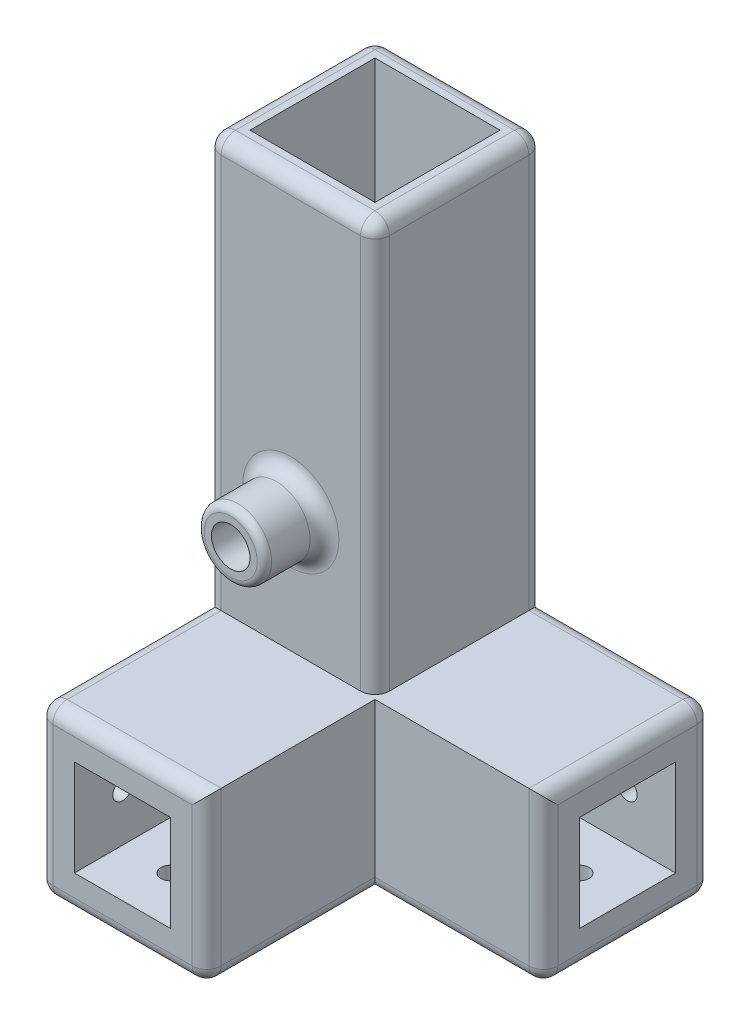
SolidWorks part; units mm, degrees
ref_plane "Alzado" through (0, 0, 0) normal (0, 0, 1) x (1, 0, 0)
ref_plane "Planta" through (0, 0, 0) normal (0, 1, 0) x (1, 0, 0)
ref_plane "Vista lateral" through (0, 0, 0) normal (1, 0, 0) x (0, 0, -1)
sketch "Sketch1" plane through (0, 0, 0) normal (0, 0, 1) x (1, 0, 0)
  line L0 (0, 70) -> (0, 0)
  line L1 (0, 0) -> (70, 0)
  line L2 (70, 0) -> (70, 35)
  line L3 (70, 35) -> (35, 35)
  line L4 (35, 35) -> (35, 70)
  line L5 (35, 70) -> (0, 70)
  dimension "D1" = 70
  dimension "D2" = 70
  dimension "D3" = 35
  dimension "D4" = 35
extrude "Boss-Extrude1" add sketch "Sketch1" along normal blind 35
sketch "Sketch2" plane through (0, 0, 35) normal (0, 0, 1) x (1, 0, 0)
  line L0 (35, 35) -> (0, 35)
  line L1 (0, 70) -> (0, 0) construction
  line L2 (0, 35) -> (0, 0)
  line L3 (0, 0) -> (35, 0)
  line L4 (0, 0) -> (70, 0) construction
  line L5 (35, 0) -> (35, 35)
extrude "Boss-Extrude2" add sketch "Sketch2" along normal blind 35
sketch "Sketch3" plane through (0, 0, 70) normal (0, 0, 1) x (1, 0, 0)
  line L0 (35, 0) -> (35, 35) construction
  line L1 (7.5, 27.5) -> (27.5, 27.5)
  line L2 (7.5, 27.5) -> (7.5, 7.5)
  line L3 (7.5, 7.5) -> (27.5, 7.5)
  line L4 (27.5, 27.5) -> (27.5, 7.5)
  line L5 (7.5, 27.5) -> (27.5, 7.5) construction
  line L6 (7.5, 7.5) -> (27.5, 27.5) construction
  line L7 (0, 0) -> (35, 0) construction
  point P0 (17.5, 17.5)
  dimension "D1" = 17.5
  dimension "D2" = 17.5
  dimension "D3" = 20
  dimension "D4" = 20
sketch "Sketch4" plane through (70, 0, 0) normal (1, 0, 0) x (0, 0, -1)
  line L0 (0, 0) -> (0, 35) construction
  line L1 (-27.5, 27.5) -> (-7.5, 27.5)
  line L2 (-27.5, 27.5) -> (-27.5, 7.5)
  line L3 (-27.5, 7.5) -> (-7.5, 7.5)
  line L4 (-7.5, 27.5) -> (-7.5, 7.5)
  line L5 (-27.5, 27.5) -> (-7.5, 7.5) construction
  line L6 (-27.5, 7.5) -> (-7.5, 27.5) construction
  line L7 (-35, 0) -> (0, 0) construction
  point P0 (-17.5, 17.5)
  dimension "D1" = 20
  dimension "D2" = 20
  dimension "D3" = 17.5
  dimension "D4" = 17.5
extrude "Cut-Extrude1" cut sketch "Sketch3" against normal blind 20 contours L3 L4 L1 L2
extrude "Cut-Extrude2" cut sketch "Sketch4" against normal blind 20 contours L3 L4 L1 L2
fillet "Fillet1" radius 3 14 edges at (35, 0, 0) (70, 17.5, 0) (52.5, 35, 0) (17.5, 35, 70) (0, 0, 35) (0, 17.5, 70) (0, 35, 52.5) (70, 35, 17.5) (70, 17.5, 35) (35, 17.5, 70) (70, 0, 17.5) (52.5, 0, 35) (35, 0, 52.5) (17.5, 0, 70)
sketch "Sketch7" plane through (0, 0, 0) normal (-1, 0, 0) x (0, 0, 1)
  line L1 (67, 0) -> (3, 0) construction
  line L2 (70, 32) -> (70, 3) construction
  circle A0 centre (60, 17.5) radius 2
  dimension "D2" = 4
  dimension "D3" = 17.5
  dimension "D4" = 10
extrude "Cut-Extrude4" cut sketch "Sketch7" against normal blind 10
sketch "Sketch8" plane through (0, 0, 0) normal (0, 0, -1) x (-1, 0, 0)
  line L0 (-70, 3) -> (-70, 32) construction
  line L1 (-67, 35) -> (-35, 35) construction
  circle A0 centre (-60, 17.5) radius 2
  dimension "D1" = 4
  dimension "D2" = 10
  dimension "D3" = 17.5
extrude "Cut-Extrude5" cut sketch "Sketch8" against normal blind 10
sketch "Sketch9" plane through (0, 70, 0) normal (0, 1, 0) x (1, 0, 0)
  line L1 (0, 0) -> (35, 0)
  line L2 (0, 0) -> (0, -35)
  line L3 (0, -35) -> (35, -35)
  line L4 (35, 0) -> (35, -35)
extrude "Boss-Extrude3" add sketch "Sketch9" along normal blind 50
sketch "Sketch10" plane through (0, 120, 0) normal (0, 1, 0) x (1, 0, 0)
  line L0 (35, 0) -> (0, 0) construction
  line L1 (4.5, -4.5) -> (30.5, -4.5)
  line L2 (4.5, -4.5) -> (4.5, -30.5)
  line L3 (4.5, -30.5) -> (30.5, -30.5)
  line L4 (30.5, -4.5) -> (30.5, -30.5)
  line L5 (4.5, -4.5) -> (30.5, -30.5) construction
  line L6 (4.5, -30.5) -> (30.5, -4.5) construction
  line L7 (0, 0) -> (0, -35) construction
  point P0 (17.5, -17.5)
  dimension "D1" = 26
  dimension "D2" = 26
  dimension "D3" = 17.5
  dimension "D4" = 17.5
extrude "Cut-Extrude6" cut sketch "Sketch10" against normal blind 50
fillet "Fillet2" radius 3 9 edges at (0.8787, 0.8787, 0.8787) (0, 61.5, 0) (0, 76, 35) (35, 76, 0) (17.5, 120, 0) (0, 120, 17.5) (17.5, 120, 35) (35, 77.5, 35) (35, 120, 17.5)
sketch "Sketch11" plane through (0, 0, 0) normal (-1, 0, 0) x (0, 0, 1)
  line L0 (35, 117) -> (35, 35) construction
  line L1 (3, 120) -> (32, 120) construction
  circle A0 centre (17.5, 100) radius 2
  dimension "D1" = 4
  dimension "D2" = 17.5
  dimension "D3" = 20
extrude "Cut-Extrude7" cut sketch "Sketch11" against normal blind 20
sketch "Sketch12" plane through (0, 0, 0) normal (0, 0, -1) x (-1, 0, 0)
  line L0 (-32, 120) -> (-3, 120) construction
  line L1 (0, 117) -> (0, 3) construction
  circle A0 centre (-17.5, 100) radius 2
  dimension "D1" = 4
  dimension "D2" = 20
  dimension "D3" = 17.5
extrude "Cut-Extrude8" cut sketch "Sketch12" against normal blind 20
sketch "Sketch13" plane through (0, 0, 0) normal (0, -1, 0) x (1, 0, 0)
  line L0 (67, 0) -> (3, 0) construction
  line L1 (70, 32) -> (70, 3) construction
  line L3 (35, 67) -> (35, 35) construction
  line L4 (3, 70) -> (32, 70) construction
  circle A0 centre (17.5, 60) radius 2
  circle A1 centre (60, 17.5) radius 2
  point P12 (17.1412, 61.9251)
  dimension "D1" = 4
  dimension "D2" = 4
  dimension "D3" = 17.5
  dimension "D4" = 10
  dimension "D5" = 17.5
  dimension "D6" = 10
extrude "Cut-Extrude9" cut sketch "Sketch13" against normal blind 20
sketch "Sketch14" plane through (0, 0, 35) normal (0, 0, 1) x (1, 0, 0)
  line L0 (3, 120) -> (32, 120) construction
  line L1 (0, 32) -> (0, 117) construction
  circle A0 centre (17.5, 60) radius 7
  dimension "D1" = 14
  dimension "D2" = 60
  dimension "D3" = 17.5
extrude "Boss-Extrude4" add sketch "Sketch14" along normal blind 12.5
fillet "Fillet3" radius 3 1 edges at (24.5, 60, 35)
sketch "Sketch15" plane through (0, 0, 47.5) normal (0, 0, 1) x (1, 0, 0)
  circle A0 centre (17.5, 60) radius 4
  dimension "D1" = 8
extrude "Cut-Extrude10" cut sketch "Sketch15" against normal blind 30
fillet "Fillet4" radius 1.5 1 edges at (24.5, 60, 47.5)
